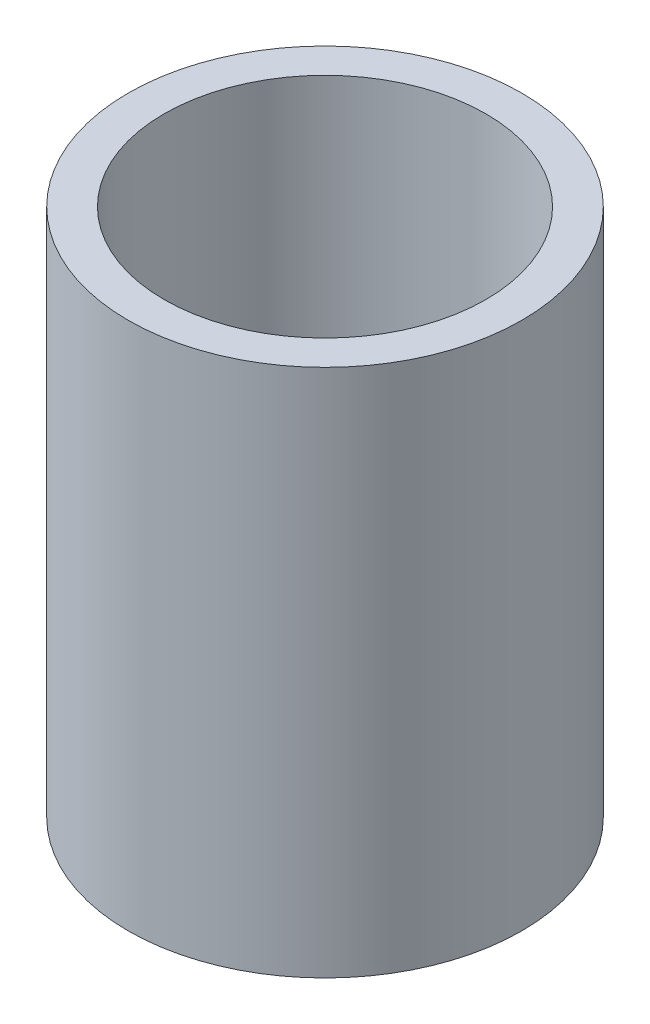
SolidWorks part; units mm, degrees
ref_plane "Front Plane" through (0, 0, 0) normal (0, 0, 1) x (1, 0, 0)
ref_plane "Top Plane" through (0, 0, 0) normal (0, 1, 0) x (1, 0, 0)
ref_plane "Right Plane" through (0, 0, 0) normal (1, 0, 0) x (0, 0, -1)
sketch "Sketch1" plane through (0, 0, 0) normal (0, 0, 1) x (1, 0, 0)
  line L0 (8.001, 1.1906) -> (8.001, -1.1906)
  line L1 (8.001, -1.1906) -> (10.8204, -1.1906)
  line L2 (10.8204, -1.1906) -> (10.8204, -17.78)
  line L3 (10.8204, -17.78) -> (13.2334, -17.78)
  line L4 (13.2334, -17.78) -> (13.2334, 17.78)
  line L5 (13.2334, 17.78) -> (10.8204, 17.78)
  line L6 (10.8204, 17.78) -> (10.8204, 1.1906)
  line L7 (10.8204, 1.1906) -> (8.001, 1.1906)
  line L8 (0, 17.78) -> (0, -17.78) construction
  line L9 (8.001, 0) -> (0, 0) construction
  dimension "ConnLength" = 35.56
  dimension "ConnOD" = 26.4668
  dimension "ConnID" = 21.6408
  dimension "ConnGap" = 2.3813
  dimension "PipeID" = 16.002
revolve "Revolve1" add sketch "Sketch1" angle 360 about L8
